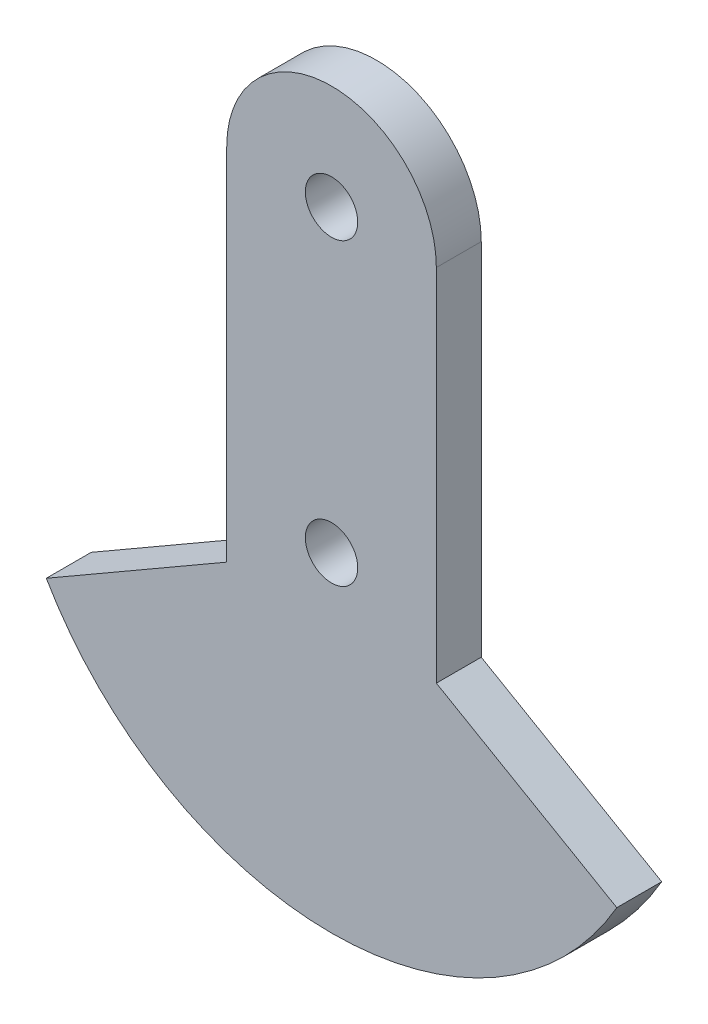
SolidWorks part; units mm, degrees
ref_plane "Front Plane" through (0, 0, 0) normal (0, 0, 1) x (1, 0, 0)
ref_plane "Top Plane" through (0, 0, 0) normal (0, 1, 0) x (1, 0, 0)
ref_plane "Right Plane" through (0, 0, 0) normal (1, 0, 0) x (0, 0, -1)
sketch "Sketch1" plane through (0, 0, 0) normal (0, 0, 1) x (1, 0, 0)
  line L0 (0, 0) -> (0, -20) construction
  line L1 (7, 0) -> (7, -24.0415)
  line L2 (-7, 0) -> (-7, -24.0415)
  line L3 (7, -24.0415) -> (19.0526, -31)
  line L4 (-7, -24.0415) -> (-19.0526, -31)
  line L5 (7, -24.0415) -> (0, -20) construction
  line L6 (-7, -24.0415) -> (0, -20) construction
  arc A0 (7, 0) -> (-7, 0) centre (0, 0) ccw
  circle A1 centre (0, 0) radius 1.75
  circle A2 centre (0, -20) radius 1.75
  arc A4 (-19.0526, -31) -> (19.0526, -31) centre (0, -20) ccw
  dimension "D1" = 14
  dimension "D2" = 3.5
  dimension "D3" = 3.5
  dimension "D4" = 22
  dimension "D5" = 20
  dimension "D6" = 60
  dimension "D7" = 60
extrude "Extrude1" add sketch "Sketch1" along normal blind 3
